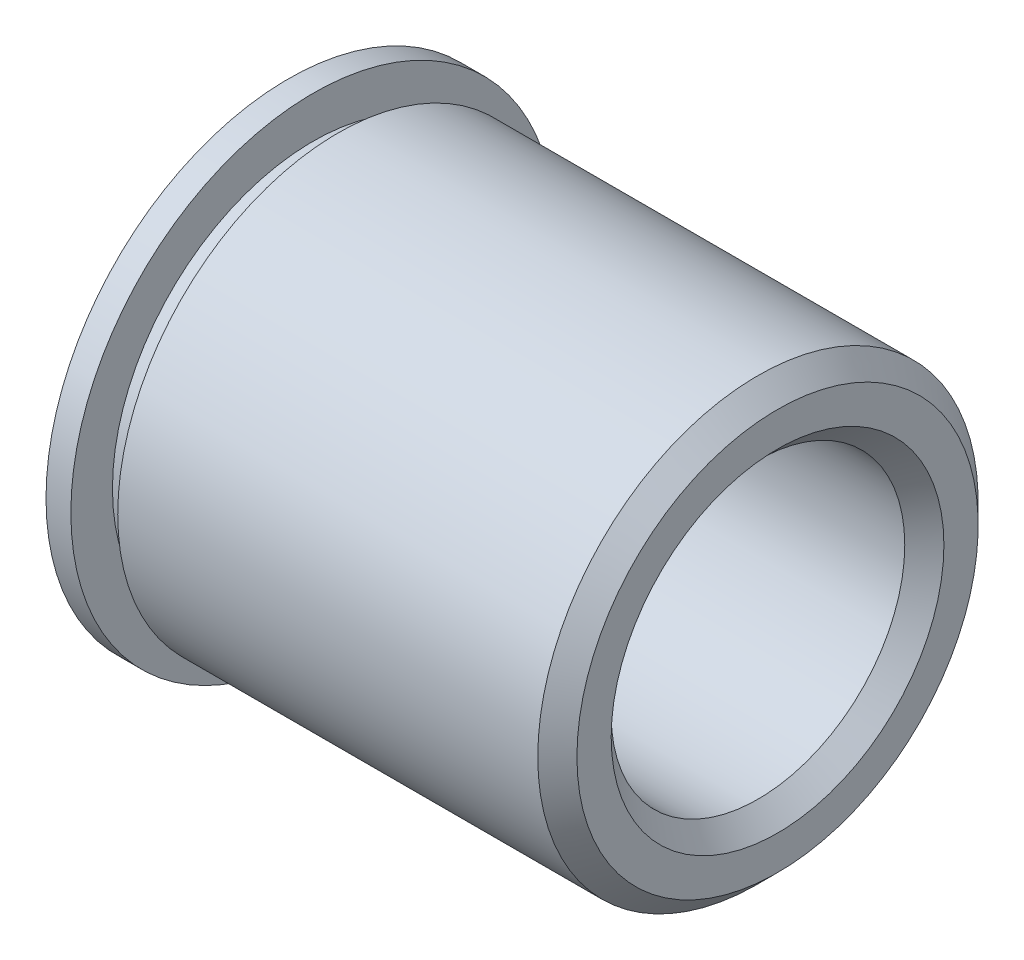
SolidWorks part; units mm, degrees
ref_plane "Front Plane" through (0, 0, 0) normal (0, 0, 1) x (1, 0, 0)
ref_plane "Top Plane" through (0, 0, 0) normal (0, 1, 0) x (1, 0, 0)
ref_plane "Right Plane" through (0, 0, 0) normal (1, 0, 0) x (0, 0, -1)
sketch "Sketch1" plane through (0, 0, 0) normal (0, 0, 1) x (1, 0, 0)
  line L0 (-67.8249, 0) -> (74.2137, 0) construction
  line L1 (74.2137, 0) -> (74.2137, 2.25)
  line L2 (74.2137, 2.25) -> (69.7217, 2.25)
  line L3 (69.7217, 2.25) -> (69.7217, 2.05)
  line L4 (69.7217, 2.05) -> (69.4677, 2.05)
  line L5 (69.4677, 2.05) -> (69.4677, 2.475)
  line L6 (69.4677, 2.475) -> (69.2137, 2.475)
  line L7 (69.2137, 2.475) -> (69.2137, 0)
  line L8 (69.2137, 0) -> (74.2137, 0)
  dimension "D1" = 2.25
  dimension "D2" = 5
  dimension "D3" = 0.254
  dimension "D4" = 0.254
  dimension "D5" = 0.2
  dimension "D6" = 2.475
revolve "Revolve1" add sketch "Sketch1" angle 360 about L0
sketch "Sketch2" plane through (74.2137, 0, 0) normal (1, 0, 0) x (0, 0, -1)
  circle A0 centre (0, 0) radius 1.5
  dimension "D1" = 3
extrude "Cut-Extrude1" cut sketch "Sketch2" against normal through all contours A0
chamfer "Chamfer1" distance 0.2 angle 45 1 edges at (74.2137, 0, 2.25)
chamfer "Chamfer2" distance 0.2 angle 45 2 edges at (69.2137, 0, -1.5) (74.2137, 0, -1.5)
